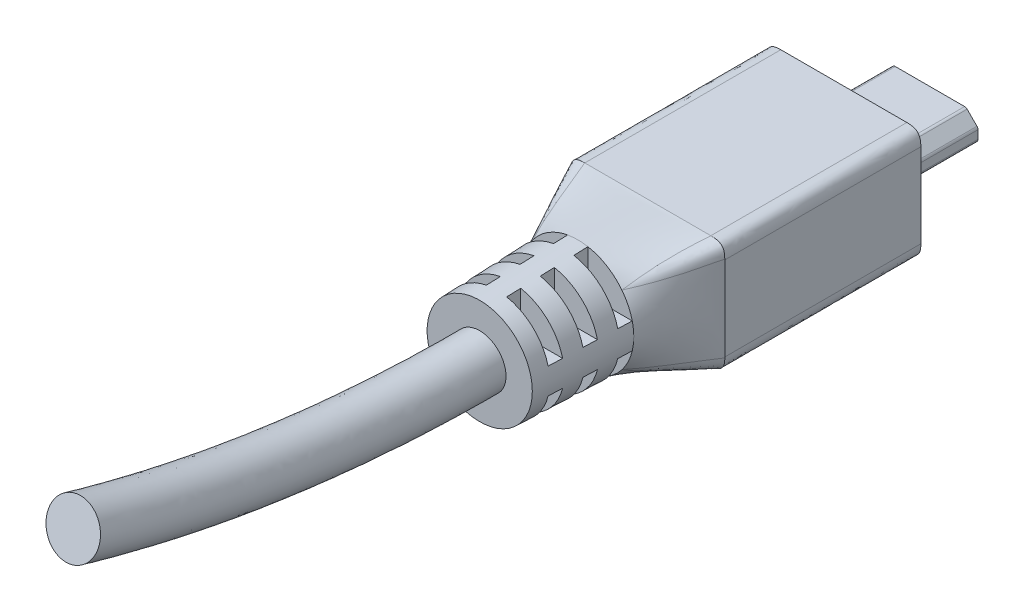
SolidWorks part; units mm, degrees
ref_plane "Front Plane" through (0, 0, 0) normal (0, 0, 1) x (1, 0, 0)
ref_plane "Top Plane" through (0, 0, 0) normal (0, 1, 0) x (1, 0, 0)
ref_plane "Right Plane" through (0, 0, 0) normal (1, 0, 0) x (0, 0, -1)
sketch "Sketch1" plane through (0, 0, 0) normal (0, 0, 1) x (1, 0, 0)
  line L1 (-5.5, 4) -> (5.5, 4)
  line L2 (-5.5, 4) -> (-5.5, -4)
  line L3 (-5.5, -4) -> (5.5, -4)
  line L4 (5.5, 4) -> (5.5, -4)
  line L5 (-5.5, 4) -> (5.5, -4) construction
  line L6 (-5.5, -4) -> (5.5, 4) construction
  point P0 (0, 0)
  dimension "D1" = 11
  dimension "D2" = 8
extrude "Boss-Extrude1" add sketch "Sketch1" along normal blind 14
ref_plane "Plane1" through (0, 0, 19) normal (0, 0, 1) x (1, 0, 0)
sketch "Sketch2" plane through (0, 0, 19) normal (0, 0, 1) x (1, 0, 0)
  line L0 (5.5, 4) -> (-5.5, 4) construction
  line L1 (5.5, 4) -> (-5.5, 4) construction
  circle A0 centre (0, 0) radius 4
other "Boundary-Surface1"
surface "Surface-Plane1"
surface "Surface-Knit2"
sketch "Sketch3" plane through (0, 0, 19) normal (0, 0, 1) x (1, 0, 0)
  arc A1 (3.1608, -2.4508) -> (1.5999, 3.6657) centre (0, 0) ccw
  arc A4 (1.5999, 3.6657) -> (-3.8732, -0.9977) centre (0, 0) ccw
  arc A5 (-3.8732, -0.9977) -> (-0.0016, -3.9997) centre (0, 0) ccw
  arc A7 (-0.0016, -3.9997) -> (3.1608, -2.4508) centre (0, 0) ccw
  spline S0 degree 3 poles (-3.1611, 2.451) (-2.7896, 2.9301) (-1.8255, 3.7165) (-0.0077, 4.1404) (1.8118, 3.7232) (2.7788, 2.9404) (3.152, 2.4627) knots 0 0 0 0 0.25 0.5 0.75 1 1 1 1 construction
  point P3 (0, 0)
  point P4 (0, 0)
extrude "Boss-Extrude2" add sketch "Sketch3" along normal blind 7
draft "Draft1" type of draft neutral plane draft angle 2 neutral plane "Plane1" faces to draft 1 parameters "D1"=2
sketch "Sketch4" plane through (0, 0, 19) normal (0, 0, 1) x (1, 0, 0)
  line L0 (-0.725, 3.9336) -> (-0.725, 1.7292)
  line L1 (0.725, 3.9336) -> (0.725, 1.7292)
  line L2 (1.631, 0.925) -> (3.8916, 0.925)
  line L3 (1.631, -0.925) -> (3.8916, -0.925)
  line L4 (-1000, 0) -> (-1.875, 0) construction
  line L5 (0, -4.0002) -> (0, 4.0002) construction
  line L6 (-0.725, -3.9336) -> (-0.725, -1.7292)
  line L7 (0.725, -3.9336) -> (0.725, -1.7292)
  line L8 (-1.631, -0.925) -> (-3.8916, -0.925)
  line L9 (-1.631, 0.925) -> (-3.8916, 0.925)
  line L10 (0, 0) -> (4.0001, 0) construction
  arc A0 (-1.631, -0.925) -> (-0.725, -1.7292) centre (0, 0) ccw
  arc A1 (0.725, -1.7292) -> (1.631, -0.925) centre (0, 0) ccw
  arc A2 (-0.725, 1.7292) -> (-1.631, 0.925) centre (0, 0) ccw
  arc A3 (1.631, 0.925) -> (0.725, 1.7292) centre (0, 0) ccw
  spline S1 degree 3 poles (-3.1611, 2.451) (-2.7896, 2.9301) (-2.0168, 3.5605) (-1.0847, 3.8671) (-0.725, 3.9336) knots 0 0 0 0 0.25 0.400809 0.400809 0.400809 0.400809
  spline S4 degree 3 poles (-3.152, -2.4627) (-3.4235, -2.1152) (-3.701, -1.6048) (-3.861, -1.0537) (-3.8916, -0.925) knots 0 0 0 0 0.25 0.324982 0.324982 0.324982 0.324982
  spline S5 degree 3 poles (3.1611, -2.451) (2.7896, -2.9301) (2.0168, -3.5605) (1.0847, -3.8671) (0.725, -3.9336) knots 0 0 0 0 0.25 0.400806 0.400806 0.400806 0.400806
  spline S7 degree 3 poles (3.152, 2.4627) (3.4235, 2.1152) (3.701, 1.6048) (3.861, 1.0537) (3.8916, 0.925) knots 0 0 0 0 0.25 0.324982 0.324982 0.324982 0.324982
  spline S8 degree 3 poles (-3.8916, 0.925) (-3.8622, 1.0489) (-3.7046, 1.5955) (-3.4313, 2.1026) (-3.1611, 2.451) knots 0.677812 0.677812 0.677812 0.677812 0.75 1 1 1 1
  spline S9 degree 3 poles (-0.725, -3.9336) (-1.0799, -3.8681) (-2.0075, -3.5647) (-2.7788, -2.9404) (-3.152, -2.4627) knots 0.601222 0.601222 0.601222 0.601222 0.75 1 1 1 1
  spline S10 degree 3 poles (0.725, 3.9336) (1.0799, 3.868) (2.0075, 3.5647) (2.7788, 2.9404) (3.152, 2.4627) knots 0.601225 0.601225 0.601225 0.601225 0.75 1 1 1 1
  spline S11 degree 3 poles (3.8916, -0.925) (3.8622, -1.0489) (3.7046, -1.5955) (3.4313, -2.1026) (3.1611, -2.451) knots 0.677812 0.677812 0.677812 0.677812 0.75 1 1 1 1
  point P15 (0, 0)
  point P20 (3.876, 0.9882)
  dimension "D1" = 3.75
  dimension "D2" = 1.45
  dimension "D3" = 1.85
extrude "Cut-Extrude1" cut sketch "Sketch4" along normal blind 1
pattern_linear "LPattern1" count 3 spacing 2.4 along (0, 0, 1) of "Cut-Extrude1"
fillet "Fillet1" radius 1 4 edges at (-5.5, -4, 7) (5.5, -4, 7) (5.5, 4, 7) (-5.5, 4, 7)
fillet "Fillet2" radius 1 4 edges
sketch "Sketch5" plane through (0, 0, 26) normal (0, 0, 1) x (1, 0, 0)
  arc A1 (-0.725, 1.7292) -> (-1.631, 0.925) centre (0, 0) ccw construction
  arc A2 (-0.725, 1.7292) -> (-1.631, 0.925) centre (0, 0) ccw construction
  circle A3 centre (0, 0) radius 1.875
sketch "Sketch6" plane through (0, 0, 0) normal (1, 0, 0) x (0, 0, -1)
  line L0 (-26, 3.7552) -> (-26, -3.7552)
  line L1 (-26, 3.7552) -> (-26, -3.7552) construction
  spline S0 degree 2 poles (-26, 0) (-40.7362, 0) (-55.027, 4.1342) knots 0 0 0 1 1 1
  point P2 (-38.0311, 2.1087)
  point P4 (-33.6592, 0)
  point P5 (-56.329, 4.4168)
sweep "Sweep1" add profiles "Sketch5" path "Sketch6"
sketch "Sketch7" plane through (0, 0, 0) normal (0, 0, -1) x (-1, 0, 0)
  line L0 (-3.43, 0.05) -> (-2.58, 0.9)
  line L1 (-2.58, 0.9) -> (2.58, 0.9)
  line L2 (-3.43, 0.05) -> (-3.43, -0.9)
  line L3 (-3.43, -0.9) -> (3.43, -0.9)
  line L4 (3.43, 0.05) -> (3.43, -0.9)
  line L5 (-3.43, 0.9) -> (3.43, -0.9) construction
  line L6 (-3.43, -0.9) -> (3.43, 0.9) construction
  line L7 (2.58, 0.9) -> (3.43, 0.05)
  point P0 (0, 0)
  dimension "D1" = 6.86
  dimension "D2" = 1.8
extrude "Boss-Extrude3" add sketch "Sketch7" along normal blind 6.15
fillet "Fillet4" radius 0.25 6 edges at (-3.43, -0.9, -3.075) (3.43, -0.9, -3.075) (3.43, 0.05, -3.075) (2.58, 0.9, -3.075) (-3.43, 0.05, -3.075) (-2.58, 0.9, -3.075)
sketch "Sketch8" plane through (0, 0, -6.15) normal (0, 0, -1) x (-1, 0, 0)
  line L0 (0, -1000) -> (0, 49000) construction
  line L1 (-1.8, -0.65) -> (1.8, -0.65)
  line L2 (-1.8, -0.65) -> (-1.8, 0.35)
  line L3 (-1.8, 0.35) -> (1.8, 0.35)
  line L4 (1.8, -0.65) -> (1.8, 0.35)
  line L5 (-3.18, -0.9) -> (3.18, -0.9) construction
  point P5 (0, 0)
  dimension "D1" = 3.6
  dimension "D2" = 1
  dimension "D3" = 0.25
extrude "Cut-Extrude2" cut sketch "Sketch8" against normal blind 2.75
